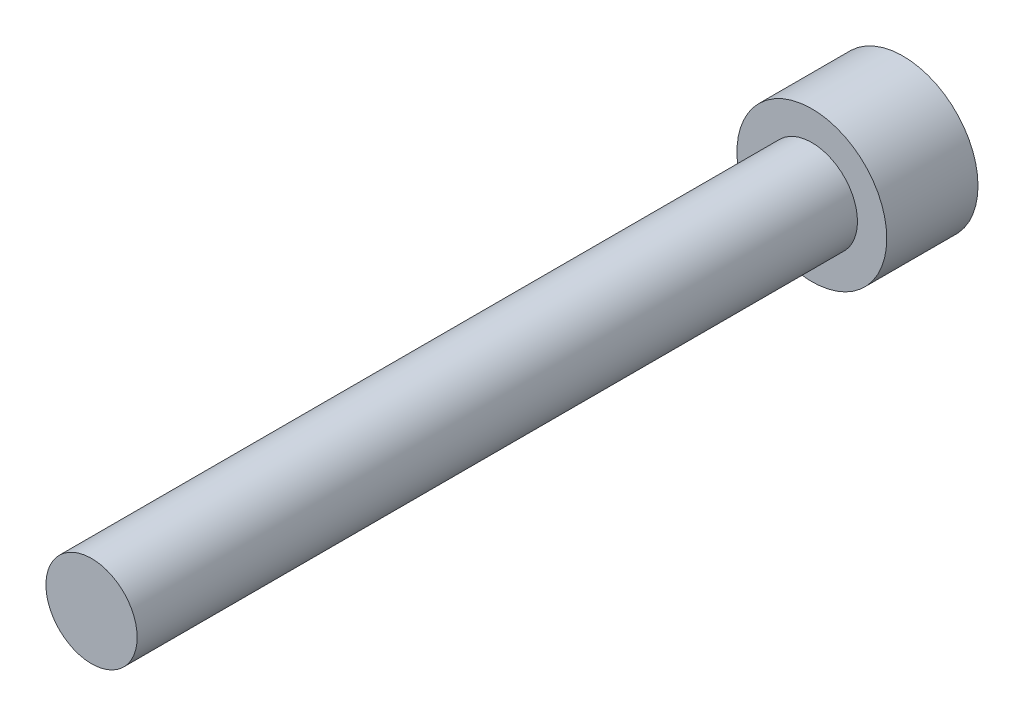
SolidWorks part; units mm, degrees
ref_plane "Front Plane" through (0, 0, 0) normal (0, 0, 1) x (1, 0, 0)
ref_plane "Top Plane" through (0, 0, 0) normal (0, 1, 0) x (1, 0, 0)
ref_plane "Right Plane" through (0, 0, 0) normal (1, 0, 0) x (0, 0, -1)
sketch "Sketch6" plane through (0, 0, 0) normal (1, 0, 0) x (0, 0, -1)
  line L0 (-38.1, 0) -> (22.525, 0) construction
  line L1 (4.3586, 0) -> (-4.3586, 0) construction
  line L2 (-38.1, 0) -> (-38.1, -2.413)
  line L3 (-38.1, -2.413) -> (0, -2.413)
  line L4 (0, 4.3586) -> (0, -4.3586) construction
  line L5 (0, -2.413) -> (0, -3.9624)
  line L6 (0, -3.9624) -> (4.826, -3.9624)
  line L7 (4.826, -3.9624) -> (4.826, 0)
  line L8 (4.826, 0) -> (-38.1, 0)
  dimension "L" = 38.1
  dimension "H" = 4.826
  dimension "A" = 7.9248
  dimension "D" = 4.826
revolve "Revolve1" add sketch "Sketch6" angle 360 about L0
sketch "Sketch7" plane through (0, 0, -4.826) normal (0, 0, -1) x (-1, 0, 0)
  line L2 (-1.9812, 1.1438) -> (-1.9812, -1.1438)
  line L4 (-1.9812, -1.1438) -> (0, -2.2877)
  line L5 (0, -2.2877) -> (1.9812, -1.1438)
  line L6 (1.9812, -1.1438) -> (1.9812, 1.1438)
  line L7 (1.9812, 1.1438) -> (0, 2.2877)
  line L8 (0, 2.2877) -> (-1.9812, 1.1438)
  circle A0 centre (0, 0) radius 1.9812 construction
  dimension "J" = 3.9624
extrude "HEX" cut sketch "Sketch7" against normal blind 3.048
